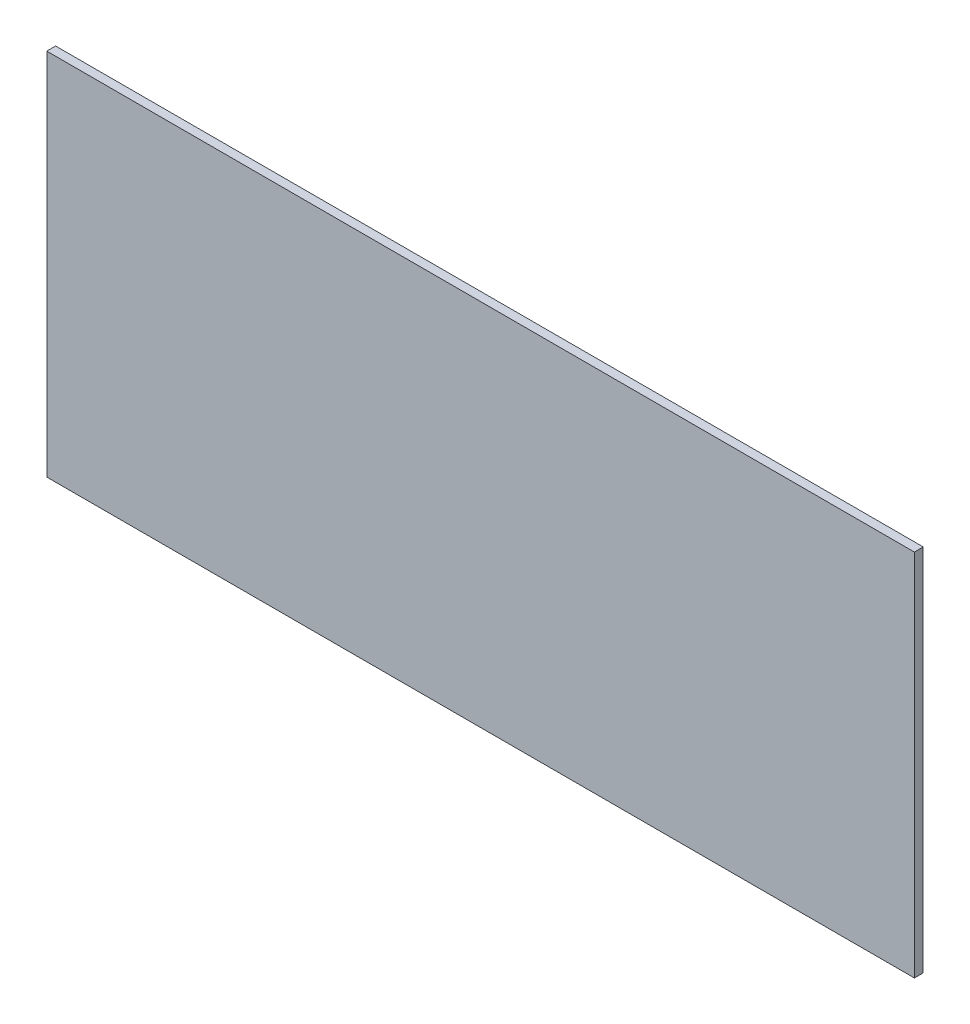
SolidWorks part; units mm, degrees
ref_plane "Plano frontal" through (0, 0, 0) normal (0, 0, 1) x (1, 0, 0)
ref_plane "Plano superior" through (0, 0, 0) normal (0, 1, 0) x (1, 0, 0)
ref_plane "Plano direito" through (0, 0, 0) normal (1, 0, 0) x (0, 0, -1)
sketch "Esboço1" plane through (0, 0, 0) normal (0, 0, 1) x (1, 0, 0)
  line L1 (-294, 125) -> (294, 125)
  line L2 (-294, 125) -> (-294, -125)
  line L3 (-294, -125) -> (294, -125)
  line L4 (294, 125) -> (294, -125)
  line L5 (-294, 125) -> (294, -125) construction
  line L6 (-294, -125) -> (294, 125) construction
  point P0 (0, 0)
extrude "Ressalto-extrusão1" add sketch "Esboço1" along normal blind 6
